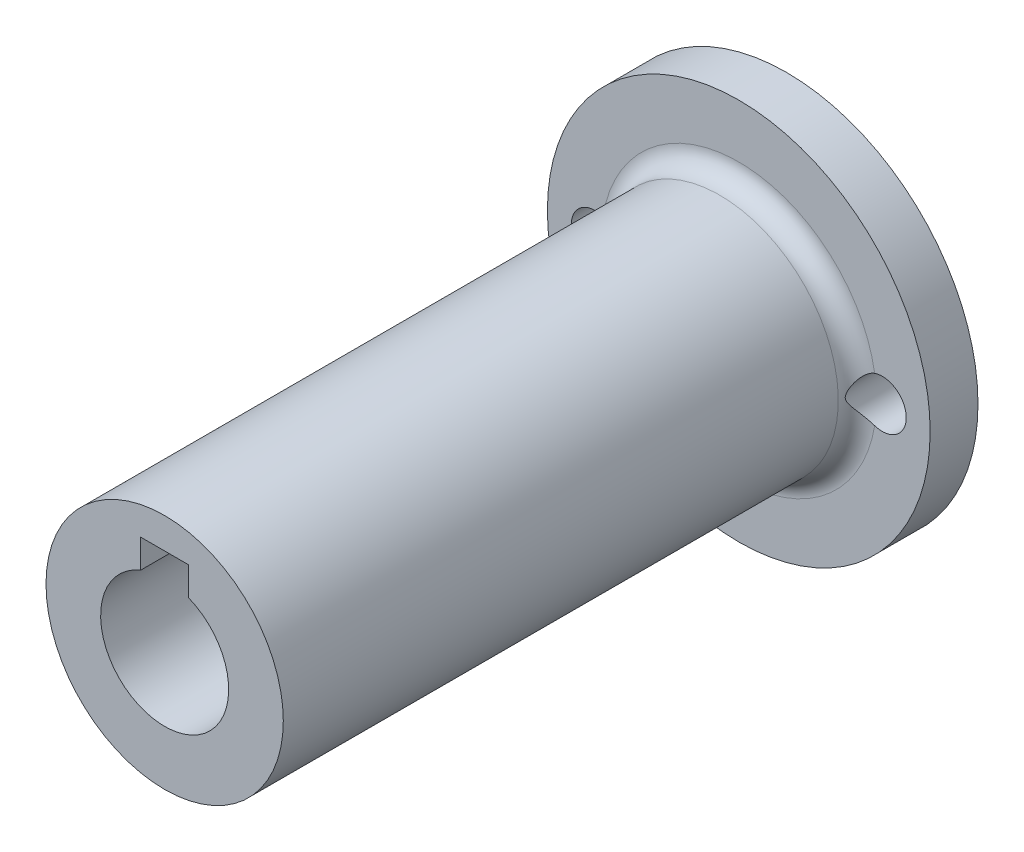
SolidWorks part; units mm, degrees
ref_plane "Front Plane" through (0, 0, 0) normal (0, 0, 1) x (1, 0, 0)
ref_plane "Top Plane" through (0, 0, 0) normal (0, 1, 0) x (1, 0, 0)
ref_plane "Right Plane" through (0, 0, 0) normal (1, 0, 0) x (0, 0, -1)
sketch "Sketch1" plane through (0, 0, 0) normal (0, 0, 1) x (1, 0, 0)
  circle A0 centre (0, 0) radius 25.4
  dimension "D1" = 50.8
extrude "Boss-Extrude1" add sketch "Sketch1" along normal blind 6.35
sketch "Sketch2" plane through (0, 0, 6.35) normal (0, 0, 1) x (1, 0, 0)
  circle A0 centre (0, 0) radius 15.748
  dimension "D1" = 31.496
extrude "Boss-Extrude2" add sketch "Sketch2" along normal blind 76.2
fillet "Fillet1" radius 2.54 1 edges at (15.748, 0, 6.35)
sketch "Sketch3" plane through (0, 0, 82.55) normal (0, 0, 1) x (1, 0, 0)
  line L1 (-3.175, 5.3213) -> (3.175, 5.3213)
  line L2 (-3.175, 5.3213) -> (-3.175, 11.6713)
  line L3 (-3.175, 11.6713) -> (3.175, 11.6713)
  line L4 (3.175, 5.3213) -> (3.175, 11.6713)
  line L5 (-3.175, 5.3213) -> (3.175, 11.6713) construction
  line L6 (-3.175, 11.6713) -> (3.175, 5.3213) construction
  circle A0 centre (0, 0) radius 8.4963
  point P3 (0, 8.4963)
  dimension "D1" = 16.9926
  dimension "D2" = 6.35
  dimension "D3" = 6.35
extrude "Cut-Extrude2" cut sketch "Sketch3" against normal through all contours L2 A0 L4 L1 | A0 L4 L3 L2
sketch "Sketch4" plane through (0, 0, 0) normal (0, 0, -1) x (-1, 0, 0)
  line L0 (0, 0) -> (0, 19.4953) construction
  line L1 (0, 0) -> (21.7406, 0) construction
  circle A0 centre (19.05, 0) radius 3.175
  circle A1 centre (-19.05, 0) radius 3.175
  dimension "D1" = 6.35
  dimension "D2" = 19.05
extrude "Cut-Extrude3" cut sketch "Sketch4" against normal through all
